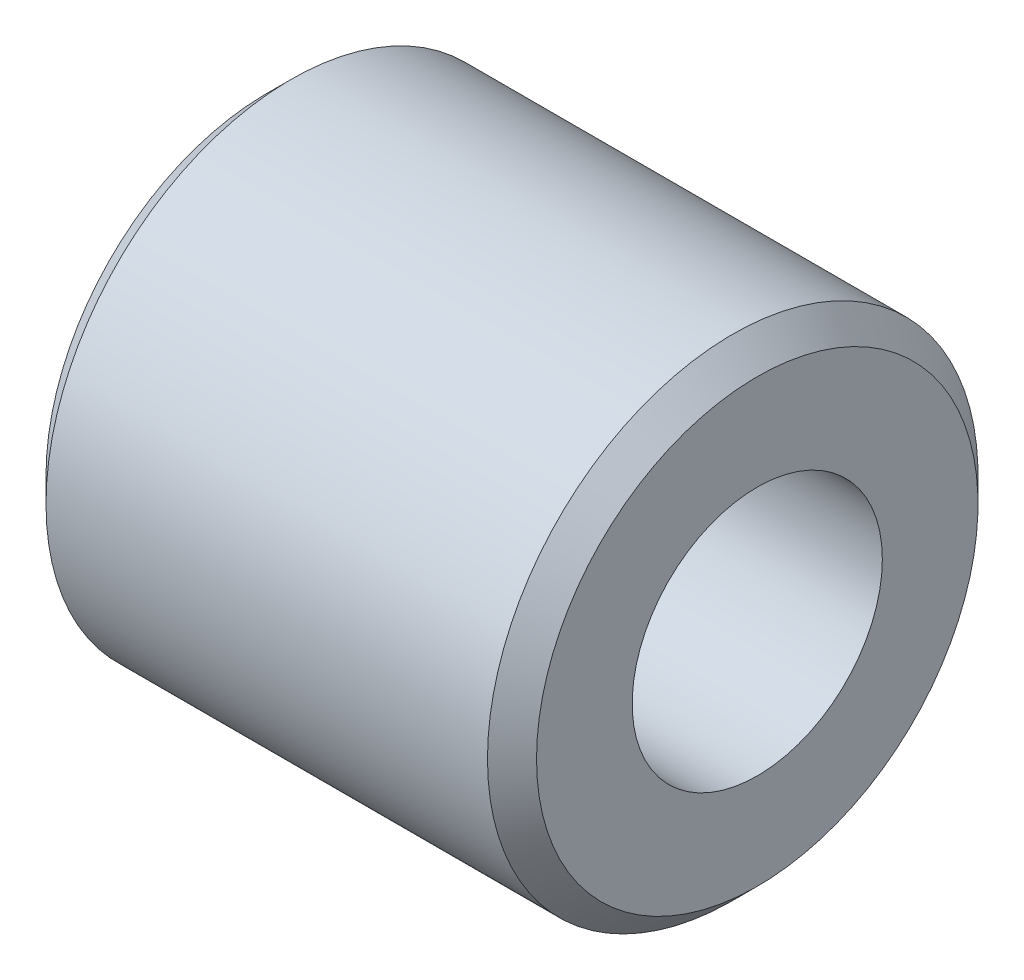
SolidWorks part; units mm, degrees
ref_plane "Face" through (0, 0, 0) normal (0, 0, 1) x (1, 0, 0)
ref_plane "Dessus" through (0, 0, 0) normal (0, 1, 0) x (1, 0, 0)
ref_plane "Droite" through (0, 0, 0) normal (1, 0, 0) x (0, 0, -1)
sketch "Esquisse1" plane through (0, 0, 0) normal (0, 0, 1) x (1, 0, 0)
  line L0 (0, 0) -> (-20, 0)
  line L1 (-20, 0) -> (-20, 9)
  line L2 (-19, 10) -> (-1, 10)
  line L3 (0, 9) -> (0, 0)
  line L4 (-1, 10) -> (0, 9)
  line L5 (-20, 9) -> (-19, 10)
  line L6 (-22.0391, 0) -> (0, 0) construction
  point P2 (-20, 10)
  point P3 (0, 10)
  dimension "D1" = 10
  dimension "D2" = 20
  dimension "D5" = 1
  dimension "D6" = 1
revolve "Base-Révolution" add sketch "Esquisse1" angle 360 about L6
hole_wizard "Trou taraudé M12x1.751" positions "Esquisse3" profile "Esquisse2" tap size "M12x1.75" standard "ISO"
sketch "Esquisse3" plane through (0, 0, 0) normal (1, 0, 0) x (0, 0, -1)
  circle A0 centre (0, 0) radius 9 construction
  point P0 (0, 0)
sketch "Esquisse2" plane through (0, 0, 0) normal (0, 1, 0) x (0, 0, -1)
  line L0 (0, 0) -> (0, 20)
  line L1 (0, 20) -> (5.1, 20)
  line L2 (5.1, 20) -> (5.1, 0)
  line L5 (5.1, 0) -> (0, 0)
  line L11 (0, -6.35) -> (0, 107.95) construction
  dimension "Diamètre du perçage jusqu'au prochain" = 10.2
  dimension "Profondeur du perçage jusqu'au prochain" = 20
